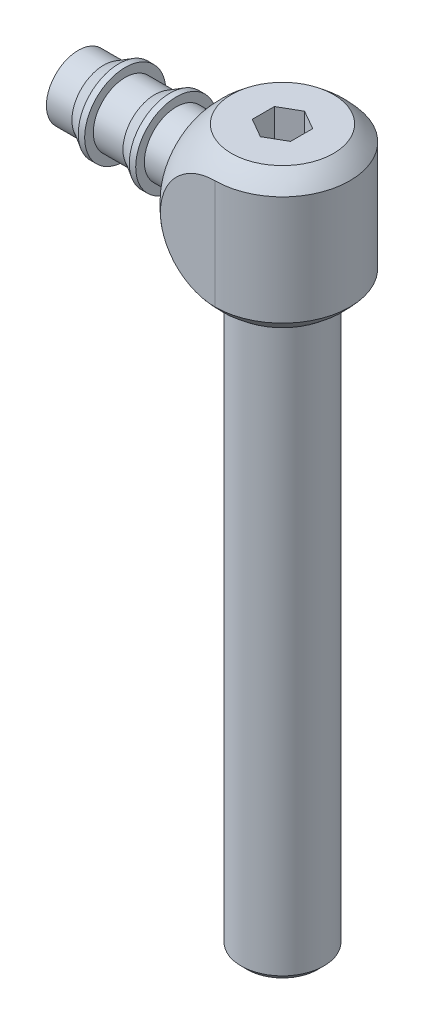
SolidWorks part; units mm, degrees
ref_plane "Front Plane" through (0, 0, 0) normal (0, 0, 1) x (1, 0, 0)
ref_plane "Top Plane" through (0, 0, 0) normal (0, 1, 0) x (1, 0, 0)
ref_plane "Right Plane" through (0, 0, 0) normal (1, 0, 0) x (0, 0, -1)
ref_plane "Plane1" through (0, 14.7256, 0) normal (0, 1, 0) x (-1, 0, 0)
sketch "Sketch1" plane through (0, 0, 0) normal (0, 0, 1) x (1, 0, 0)
  line L0 (0, 0) -> (0, 50000) construction
  line L1 (0, 25.5206) -> (0, 3.9307)
  line L2 (9.2202, 14.7256) -> (-9.2202, 14.7256) construction
  arc A1 (0, 3.9307) -> (0, 25.5206) centre (0, 14.7256) ccw
  dimension "D1" = 21.59
revolve "Revolve1" add sketch "Sketch1" angle 360 about L0
sketch "Sketch3" plane through (0, 0, 0) normal (0, 1, 0) x (1, 0, 0)
  line L0 (2.5806, 0) -> (50002.5806, 0) construction
  line L1 (0, -8.382) -> (-8.382, -8.382)
  line L2 (-8.382, -8.382) -> (-8.382, 8.382)
  line L3 (0, 8.382) -> (-8.382, 8.382)
  circle A0 centre (0, 0) radius 8.382 construction
  arc A1 (0, -8.382) -> (0, 8.382) centre (0, 0) ccw
  point P12 (-8.382, 0)
  dimension "D1" = 16.764
extrude "Cut-Extrude1" cut sketch "Sketch3" against normal through all and the other way through all flip side to cut
sketch "Sketch4" plane through (0, 0, 0) normal (0, 0, 1) x (1, 0, 0)
  line L0 (0, 0) -> (0, 50000) construction
  line L1 (-12.7, 23.4569) -> (12.7, 23.4569)
  line L2 (-12.7, 23.4569) -> (-12.7, 5.9944)
  line L3 (-12.7, 5.9944) -> (12.7, 5.9944)
  line L4 (12.7, 23.4569) -> (12.7, 5.9944)
  line L5 (0, 7.9231) -> (0, 21.5282) construction
  line L6 (0, 14.7256) -> (50000, 14.7256) construction
  line L7 (9.2202, 14.7256) -> (-9.2202, 14.7256) construction
  point P8 (0, 14.7256)
  dimension "D1" = 17.4625
  dimension "D2" = 25.4
extrude "Cut-Extrude2" cut sketch "Sketch4" against normal through all and the other way through all flip side to cut
sketch "Sketch9" plane through (0, 14.7256, 0) normal (0, 1, 0) x (1, 0, 0)
  line L0 (0, 0) -> (50000, 0) construction
  line L1 (-25.4, 0) -> (-25.4, 3.9688)
  line L2 (-25.4, 3.9688) -> (-22.225, 3.9688)
  line L3 (-22.225, 3.9688) -> (-20.3553, 5.0482)
  line L4 (-20.3553, 5.0482) -> (-19.5615, 5.0482)
  line L5 (-19.5615, 5.0482) -> (-19.5615, 3.9688)
  line L6 (-19.5615, 3.9688) -> (-15.875, 3.9688)
  line L7 (-15.875, 3.9688) -> (-14.0053, 5.0482)
  line L8 (-14.0053, 5.0482) -> (-13.2115, 5.0482)
  line L9 (-13.2115, 5.0482) -> (-13.2115, 3.9688)
  line L10 (-13.2115, 3.9688) -> (0, 3.9688)
  line L11 (0, 3.9688) -> (0, 0)
  line L12 (-25.4, 0) -> (0, 0)
  line L13 (0, 0) -> (0, 50000) construction
  dimension "D1" = 7.9375
  dimension "D2" = 1.0795
  dimension "D4" = 15.875
  dimension "D5" = 3.175
  dimension "D6" = 25.4
  dimension "D7" = 0.7937
  dimension "D8" = 30
revolve "Revolve2" add sketch "Sketch9" angle 360 about L0
fillet "Fillet1" radius 0.7937 1 edges at (-8.382, 14.7256, -3.9688)
sketch "Sketch10" plane through (-25.4, 0, 0) normal (-1, 0, 0) x (0, 0, 1)
  circle A0 centre (0, 14.7256) radius 2.6987
  circle A1 centre (0, 14.7256) radius 3.9688 construction
  dimension "D1" = 1.27
extrude "Cut-Extrude3" cut sketch "Sketch10" against normal up to surface (25.4 mm away)
sketch "Sketch11" plane through (0, 0, 0) normal (0, 0, 1) x (1, 0, 0)
  line L3 (5.1435, -64.6811) -> (5.1435, 2.8194)
  line L4 (4.3815, -65.4431) -> (5.1435, -64.6811)
  line L5 (0, -65.4431) -> (4.3815, -65.4431)
  line L6 (-6.348, 5.9944) -> (6.348, 5.9944) construction
  line L8 (0, 5.9944) -> (5.1435, 5.9944)
  line L9 (5.1435, 2.8194) -> (5.1435, 5.9944)
  line L10 (0, -11.634) -> (0, -50011.634) construction
  line L11 (0, 5.9944) -> (0, -65.4431)
  dimension "D1" = 71.4375
  dimension "D2" = 0
  dimension "D3" = 0.762
  dimension "D4" = 45
  dimension "D5" = 10.287
  dimension "D6" = 3.175
revolve "Revolve3" add sketch "Sketch11" angle 360 about L10
sketch "Sketch12" plane through (0, 23.4569, 0) normal (0, 1, 0) x (1, 0, 0)
  line L0 (0, -9.2202) -> (0, 9.2202) construction
  line L1 (0, -2.7496) -> (2.3812, -1.3748)
  line L2 (2.3812, -1.3748) -> (2.3812, 1.3748)
  line L3 (2.3812, 1.3748) -> (0, 2.7496)
  line L4 (0, 2.7496) -> (-2.3812, 1.3748)
  line L5 (-2.3812, 1.3748) -> (-2.3812, -1.3748)
  line L6 (-2.3812, -1.3748) -> (0, -2.7496)
  circle A0 centre (0, 0) radius 2.3813 construction
  circle A2 centre (0, 0) radius 6.348 construction
  dimension "D1" = 4.7625
extrude "Cut-Extrude4" cut sketch "Sketch12" against normal blind 3.9688
sketch "Sketch13" plane through (0, -65.4431, 0) normal (0, -1, 0) x (1, 0, 0)
  circle A1 centre (0, 0) radius 3.175
  circle A2 centre (0, 0) radius 5.1435 construction
  dimension "D1" = 6.35
extrude "Cut-Extrude5" cut sketch "Sketch13" against normal blind 82.8675
